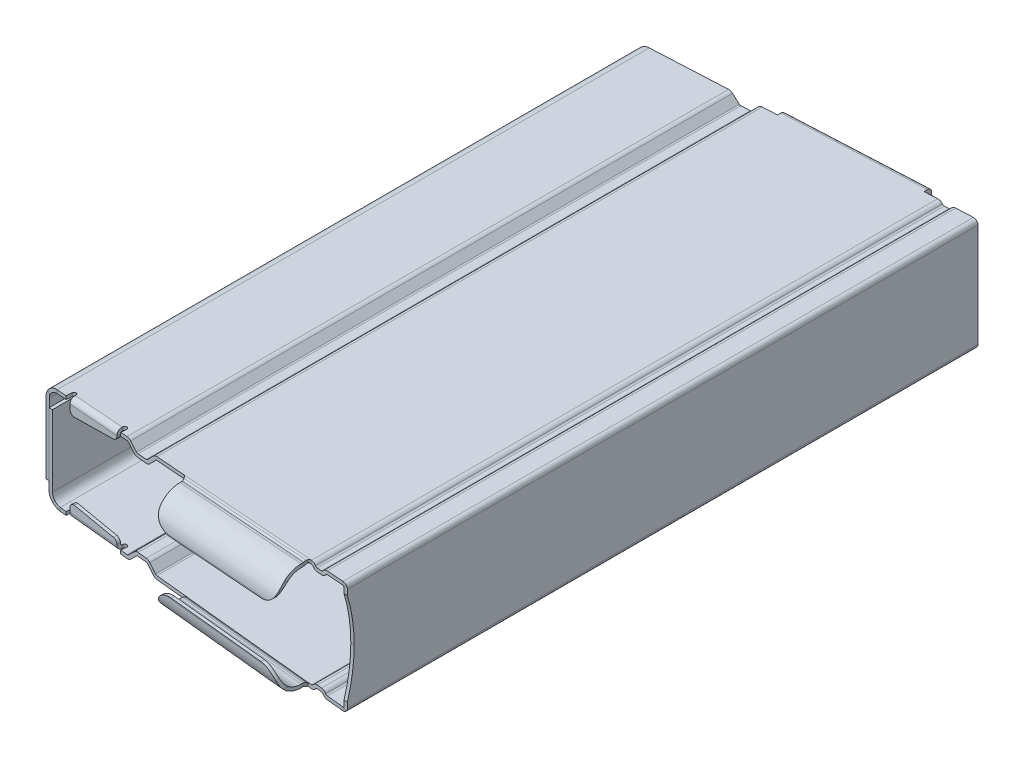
SolidWorks part; units mm, degrees
ref_plane "Front Plane" through (0, 0, 0) normal (0, 0, 1) x (1, 0, 0)
ref_plane "Top Plane" through (0, 0, 0) normal (0, 1, 0) x (1, 0, 0)
ref_plane "Right Plane" through (0, 0, 0) normal (1, 0, 0) x (0, 0, -1)
imported_body "Imported7"
sketch "Sketch1" plane through (0, 0, 0) normal (0, 1, 0) x (1, 0, 0)
  line L26 (-21.0646, -48.8833) -> (-12.1145, -49.3523)
  line L27 (-11.7822, -43.0111) -> (-18.9691, -42.6344)
  line L28 (-18.9691, -42.6344) -> (-20.7322, -42.542)
  line L32 (-9.8896, -45.113) -> (-10.0126, -47.4598)
  arc A0 (-20.7322, -42.542) -> (-21.0646, -48.8833) centre (-21.2688, -45.6932) ccw
  arc A1 (-9.8896, -45.113) -> (-11.7822, -43.0111) centre (-11.8869, -45.0083) ccw
  arc A2 (-12.1145, -49.3523) -> (-10.0126, -47.4598) centre (-12.0098, -47.3551) ccw
extrude "Cut-Extrude1" cut sketch "Sketch1" against normal through all
